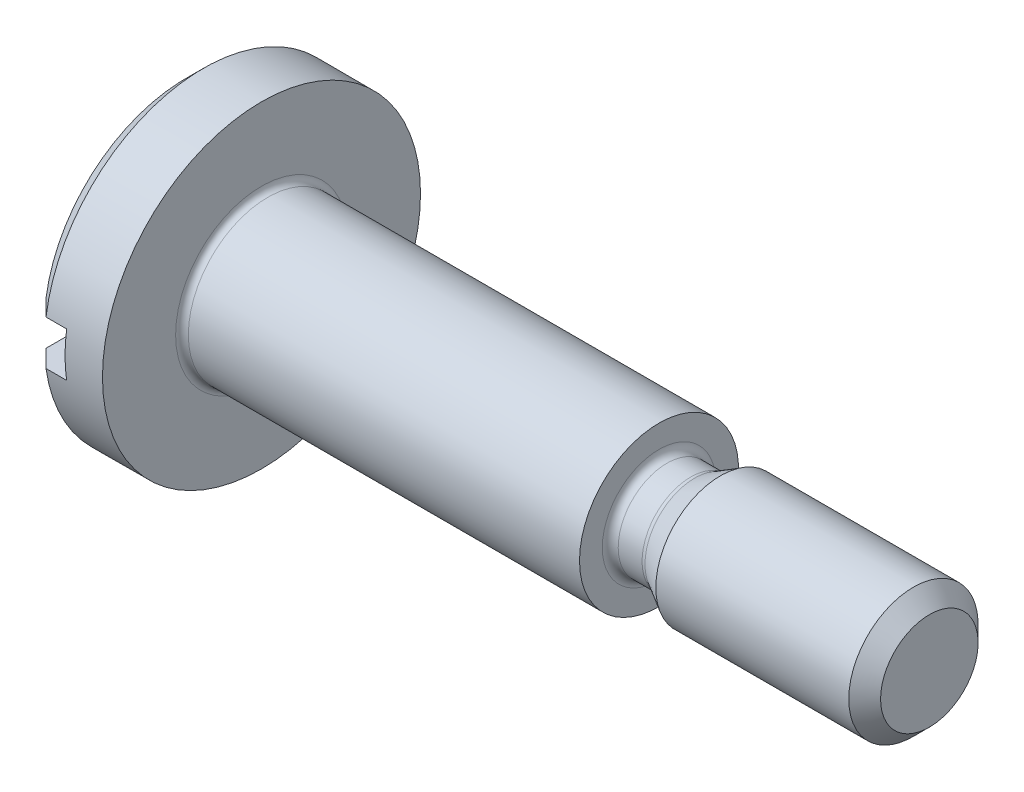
SolidWorks part; units mm, degrees
ref_plane "Plane1" through (0, 0, 0) normal (0, 0, 1) x (1, 0, 0)
ref_plane "Plane2" through (0, 0, 0) normal (0, 1, 0) x (1, 0, 0)
ref_plane "Plane3" through (0, 0, 0) normal (1, 0, 0) x (0, 0, -1)
sketch "BodySke" plane through (0, 0, 0) normal (0, 0, 1) x (1, 0, 0)
  line L0 (4.75, 5) -> (4.75, 10)
  line L1 (0, 0) -> (0, 8.9)
  line L2 (-25.4, 0) -> (127, 0) construction
  line L3 (46.75, 0) -> (0, 0)
  line L4 (4.75, 5) -> (29.75, 5)
  line L5 (46.75, 3.0663) -> (46.75, 0)
  line L6 (1.1, 10) -> (4.75, 10)
  line L7 (45.75, 4.0663) -> (33.616, 4.0663)
  line L8 (1.1, 10) -> (0, 8.9)
  line L9 (6, 6.5875) -> (6, -2.9375) construction
  line L11 (29.75, 5) -> (29.75, 3.5663)
  line L12 (30.25, 3.0663) -> (31.75, 3.0663)
  line L13 (32, 3.1333) -> (33.616, 4.0663)
  line L14 (46.75, 3.0663) -> (45.75, 4.0663)
  arc A0 (30.25, 3.0663) -> (29.75, 3.5663) centre (30.25, 3.5663) cw
  arc A1 (32, 3.1333) -> (31.75, 3.0663) centre (31.75, 3.5663) cw
  point P6 (46.75, 4.0663)
  dimension "UcutRadius" = 0.5
  dimension "D1" = 45
  dimension "Head_ht" = 4.75
  dimension "Diameter" = 10
  dimension "Length" = 25
  dimension "Head_dia" = 20
  dimension "Advance" = 1.25
  dimension "Thread_nom" = 17
  dimension "Head_chamfer" = 1.1
  dimension "Body_ch_ang" = 45
  dimension "Thread_dia" = 8.1325
  dimension "Thread_nk_ang" = 30
  dimension "Neck" = 2
revolve "Base-Revolve" add sketch "BodySke" angle 360 about L2
fillet "Fillet1" radius 0.4 1 edges at (4.75, 0, 5)
sketch "Sketch2" plane through (0, 0, 0) normal (1, 0, 0) x (0, 0, -1)
  line L0 (10, -1.4) -> (-10, -1.4)
  line L1 (10, -1.4) -> (10, 1.4)
  line L2 (-10, 1.4) -> (10, 1.4)
  line L3 (-10, 1.4) -> (-10, -1.4)
  line L4 (10, 1.4) -> (-10, -1.4) construction
  dimension "D1" = 20
  dimension "Slot_width" = 2.8
extrude "Slot" cut sketch "Sketch2" along normal blind 2.4
sketch "ThdSchSke" plane through (0, 0, 0) normal (0, 0, 1) x (1, 0, 0)
  line L0 (33, -3.0663) -> (31.646, -5)
  line L1 (33, -3.0663) -> (34.354, -5)
  line L2 (34.354, -5) -> (34.354, -6.25)
  line L3 (-3.175, 0) -> (5.1513, 0) construction
  line L5 (34.354, -6.25) -> (31.646, -6.25)
  line L6 (31.646, -6.25) -> (31.646, -5)
  line L7 (46.75, -5) -> (46.75, 5) construction
  dimension "Thread_minor" = 6.1325
  dimension "Diameter" = 10
  dimension "Start" = 13.75
  dimension "SideAngle" = 55
  dimension "VeeAngle" = 70
  dimension "Overcut" = 12.5
revolve "ThreadSchematic" [suppressed] cut sketch "ThdSchSke" angle 360 about L3
pattern_linear "ThdSchPat" [suppressed]
equation "\"D1@Sketch2\" = \"Head_dia@BodySke\""
equation "\"Thread_minor@ThreadCosmetic\" = \"Minor_dia@BodySke\""
equation "\"Thread_minor@ThdSchSke\" = \"Minor_dia@BodySke\""
equation "\"Diameter@ThdSchSke\" = \"Diameter@BodySke\""
equation "\"Overcut@ThdSchSke\" = \"Diameter@BodySke\" * 1.25"
equation "\"Start@ThdSchSke\" = \"Thread_nom@BodySke\" - \"Neck@BodySke\" - \"Advance@BodySke\""
equation "\"Num_threads@ThdSchPat\" = int( \"Start@ThdSchSke\" / \"Advance@BodySke\" + 0.999 )  + 1"
equation "\"Advance@ThdSchPat\" = \"Start@ThdSchSke\" /  (\"Num_threads@ThdSchPat\" - 1) 'relax it"
